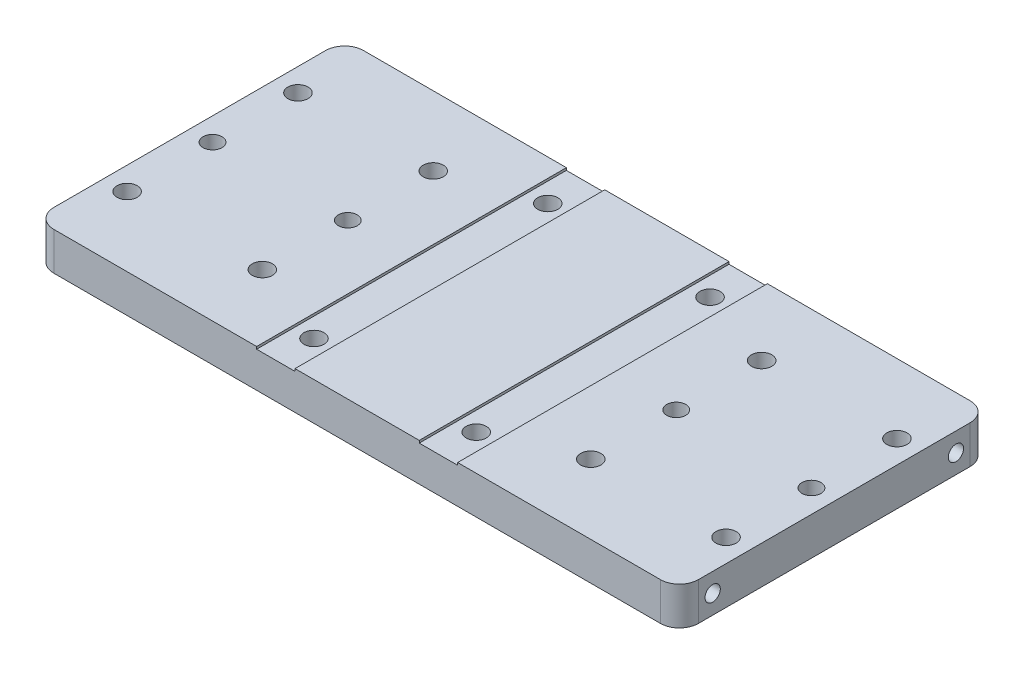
SolidWorks part; units mm, degrees
ref_plane "Front Plane" through (0, 0, 0) normal (0, 0, 1) x (1, 0, 0)
ref_plane "Top Plane" through (0, 0, 0) normal (0, 1, 0) x (1, 0, 0)
ref_plane "Right Plane" through (0, 0, 0) normal (1, 0, 0) x (0, 0, -1)
sketch "Sketch1" plane through (0, 0, 0) normal (0, 1, 0) x (1, 0, 0)
  line L1 (-107.7849, 51.7906) -> (107.7849, 51.7906)
  line L2 (-107.7849, 51.7906) -> (-107.7849, -51.7906)
  line L3 (-107.7849, -51.7906) -> (107.7849, -51.7906)
  line L4 (107.7849, 51.7906) -> (107.7849, -51.7906)
  line L5 (-107.7849, 51.7906) -> (107.7849, -51.7906) construction
  line L6 (-107.7849, -51.7906) -> (107.7849, 51.7906) construction
  point P0 (0, 0)
  dimension "D1" = 215.5698
  dimension "D2" = 103.5812
extrude "Boss-Extrude1" add sketch "Sketch1" along normal mid plane 12.7
sketch "Sketch2" plane through (0, 0, -51.7906) normal (0, 0, -1) x (-1, 0, 0)
  line L0 (-107.7849, 6.35) -> (107.7849, 6.35) construction
  line L1 (-20.7772, 5.5515) -> (-33.6042, 5.5515)
  line L2 (-20.7772, 5.5515) -> (-20.7772, 6.35)
  line L3 (-20.7772, 6.35) -> (-33.6042, 6.35)
  line L4 (-33.6042, 5.5515) -> (-33.6042, 6.35)
  line L5 (-20.7772, 5.5515) -> (-33.4772, 5.5515) construction
  line L6 (-33.4772, 39.5938) -> (-33.4772, 5.5515) construction
  line L7 (-20.7772, 39.5938) -> (-20.7772, 5.5515) construction
  line L8 (0, -6.35) -> (0, -18.9201) construction
  line L9 (-107.7849, -6.35) -> (107.7849, -6.35) construction
  line L10 (33.6042, 5.5515) -> (33.6042, 6.35)
  line L11 (20.7772, 6.35) -> (33.6042, 6.35)
  line L12 (20.7772, 5.5515) -> (20.7772, 6.35)
  line L13 (20.7772, 5.5515) -> (33.6042, 5.5515)
  dimension "D1" = 0.127
extrude "Cut-Extrude1" cut sketch "Sketch2" against normal through all
hole_wizard "CBORE for 1/4 Socket Head Cap Screw1" positions "Sketch3" profile "Sketch4" counterbore size "1/4" standard "ANSI Inch"
sketch "Sketch3" plane through (0, -6.35, 0) normal (0, -1, 0) x (-1, 0, 0)
  point P0 (27.1272, 39.0906)
  point P3 (27.1272, -39.0906)
  point P6 (-27.1272, -39.0906)
  point P9 (-27.1272, 39.0906)
sketch "Sketch4" plane through (-27.1272, -6.35, -39.0906) normal (1, 0, 0) x (0, 0, -1)
  line L0 (0, 0) -> (0, 12.7)
  line L1 (0, 12.7) -> (3.3782, 12.7)
  line L3 (3.3782, 12.7) -> (3.3782, 6.35)
  line L4 (3.3782, 6.35) -> (5.5562, 6.35)
  line L5 (5.5562, 6.35) -> (5.5563, 0)
  line L7 (5.5563, 0) -> (0, 0)
  line L11 (0, -6.35) -> (0, 107.95) construction
  dimension "Thru Hole Dia." = 6.7564
  dimension "Thru Hole Depth" = 12.7
  dimension "C'Bore Dia." = 11.1125
  dimension "C'Bore Depth" = 6.35
hole_wizard "1/4-20 Tapped Hole1" positions "Sketch5" profile "Sketch6" tap size "1/4-20" standard "ANSI Inch"
sketch "Sketch5" plane through (107.7849, -112.7125, 0) normal (1, 0, 0) x (0, -1, 0)
  line L0 (-106.3625, 0) -> (-88.0842, 0) construction
  line L1 (-106.3625, -51.7906) -> (-106.3625, 51.7906) construction
  line L3 (-112.7125, 51.7906) -> (-112.7125, 40.6781) construction
  line L4 (-119.0625, 51.7906) -> (-106.3625, 51.7906) construction
  point P0 (-112.7125, -40.6781)
  point P3 (-112.7125, 40.6781)
  dimension "D1" = 11.1125
sketch "Sketch6" plane through (107.7849, 0, 40.6781) normal (0, 1, 0) x (0, 0, -1)
  line L0 (0, 0) -> (0, 18.0438)
  line L1 (0, 18.0438) -> (2.5527, 16.51)
  line L2 (2.5527, 16.51) -> (2.5527, 0)
  line L5 (2.5527, 0) -> (0, 0)
  line L10 (0, 18.0438) -> (-2.5527, 16.51) construction
  line L11 (0, -6.35) -> (0, 107.95) construction
  dimension "Tap Drill Dia." = 5.1054
  dimension "Tap Drill Depth" = 16.51
  dimension "Drill Angle" = 118
hole_wizard "CBORE for 1/4 Socket Head Cap Screw2" positions "Sketch7" profile "Sketch8" counterbore size "1/4" standard "ANSI Inch"
sketch "Sketch7" plane through (0, -6.35, 0) normal (0, -1, 0) x (-1, 0, 0)
  point P0 (54.9148, 28.575)
  point P3 (54.9148, -28.575)
  point P6 (100.1522, -28.575)
  point P9 (100.1522, 28.575)
  point P12 (-100.1522, -28.575)
  point P15 (-100.1522, 28.575)
  point P18 (-54.9148, -28.575)
  point P21 (-54.9148, 28.575)
sketch "Sketch8" plane through (-54.9148, -6.35, -28.575) normal (1, 0, 0) x (0, 0, -1)
  line L0 (0, 0) -> (0, 12.7)
  line L1 (0, 12.7) -> (3.3782, 12.7)
  line L3 (3.3782, 12.7) -> (3.3782, 6.35)
  line L4 (3.3782, 6.35) -> (5.5562, 6.35)
  line L5 (5.5562, 6.35) -> (5.5562, 0)
  line L7 (5.5562, 0) -> (0, 0)
  line L11 (0, -6.35) -> (0, 107.95) construction
  dimension "Thru Hole Dia." = 6.7564
  dimension "Thru Hole Depth" = 12.7
  dimension "C'Bore Dia." = 11.1125
  dimension "C'Bore Depth" = 6.35
hole_wizard "1/4 (0.2500) Dowel Hole1" positions "Sketch9" profile "Sketch10" hole size "1/4" standard "ANSI Inch"
sketch "Sketch9" plane through (0, 6.35, 0) normal (0, 1, 0) x (1, 0, 0)
  point P0 (100.1522, 0)
  point P3 (54.9148, 0)
  point P6 (-100.1522, 0)
  point P9 (-54.9148, 0)
sketch "Sketch10" plane through (100.1522, 6.35, 0) normal (1, 0, 0) x (0, 0, 1)
  line L0 (0, 0) -> (0, 12.7)
  line L1 (0, 12.7) -> (3.175, 12.7)
  line L2 (3.175, 12.7) -> (3.175, 0)
  line L5 (3.175, 0) -> (0, 0)
  line L11 (0, -6.35) -> (0, 107.95) construction
  dimension "Thru Hole Dia." = 6.35
  dimension "Thru Hole Depth" = 12.7
mirror "Mirror1" about plane through (0, 0, 0) normal (1, 0, 0) of "1/4-20 Tapped Hole1"
fillet "Fillet1" radius 6.35 4 edges at (-107.7849, 0, 51.7906) (-107.7849, 0, -51.7906) (107.7849, 0, -51.7906) (107.7849, 0, 51.7906)
